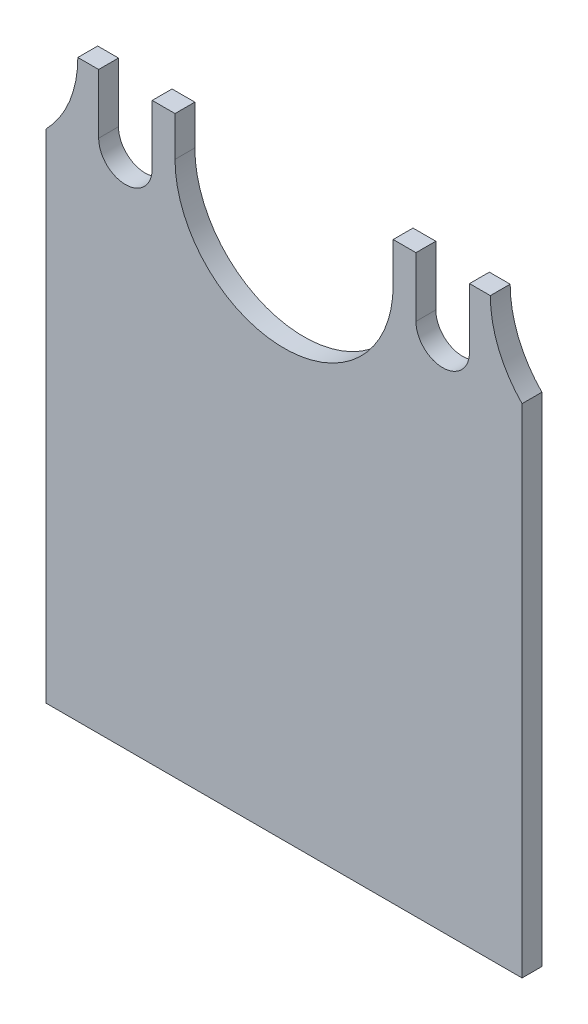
SolidWorks part; units mm, degrees
ref_plane "Vorne" through (0, 0, 0) normal (0, 0, 1) x (1, 0, 0)
ref_plane "Oben" through (0, 0, 0) normal (0, 1, 0) x (1, 0, 0)
ref_plane "Links" through (0, 0, 0) normal (1, 0, 0) x (0, 0, -1)
sketch "Skizze1" plane through (0, 0, 0) normal (0, 0, 1) x (1, 0, 0)
  line L0 (13.25, 130) -> (13.25, 145)
  line L1 (0, 0) -> (120, 0)
  line L2 (0, 0) -> (0, 125.4041)
  line L3 (8, 145) -> (13.25, 145)
  line L4 (120, 0) -> (120, 125.4041)
  line L5 (26.75, 130) -> (26.75, 145)
  line L6 (93.25, 130) -> (93.25, 145)
  line L7 (106.75, 130) -> (106.75, 145)
  line L8 (26.75, 145) -> (32.5, 145)
  line L9 (87.5, 145) -> (93.25, 145)
  line L10 (106.75, 145) -> (112, 145)
  line L11 (32.5, 135) -> (32.5, 145)
  line L12 (87.5, 135) -> (87.5, 145)
  arc A0 (32.5, 135) -> (87.5, 135) centre (60, 135) ccw
  arc A1 (13.25, 130) -> (26.75, 130) centre (20, 130) ccw
  arc A2 (93.25, 130) -> (106.75, 130) centre (100, 130) ccw
  arc A3 (0, 125.4041) -> (8, 145) centre (-20, 145) ccw
  arc A4 (112, 145) -> (120, 125.4041) centre (140, 145) ccw
  dimension "D3" = 13.5
  dimension "D4" = 13.5
  dimension "D5" = 55
  dimension "D12" = 56
  dimension "D13" = 56
  dimension "D1" = 120
  dimension "D2" = 145
  dimension "D6" = 10
  dimension "D7" = 15
  dimension "D8" = 15
  dimension "D9" = 40
  dimension "D10" = 40
  dimension "D11" = 60
  dimension "D14" = 20
  dimension "D15" = 20
extrude "Linear austragen1" add sketch "Skizze1" along normal blind 5
